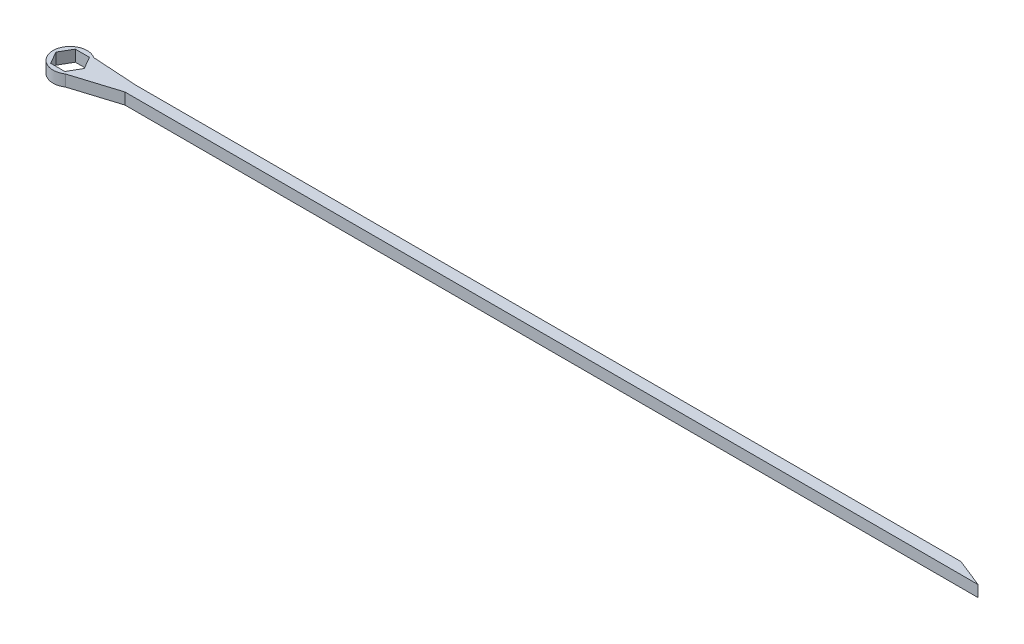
SolidWorks part; units mm, degrees
ref_plane "Front Plane" through (0, 0, 0) normal (0, 0, 1) x (1, 0, 0)
ref_plane "Top Plane" through (0, 0, 0) normal (0, 1, 0) x (1, 0, 0)
ref_plane "Right Plane" through (0, 0, 0) normal (1, 0, 0) x (0, 0, -1)
sketch "Sketch1" plane through (0, 0, 0) normal (0, 1, 0) x (1, 0, 0)
  line L0 (4.8292, 0) -> (80, 0)
  line L2 (1.25, 0) -> (0.625, 1.0825)
  line L3 (0.625, 1.0825) -> (-0.625, 1.0825)
  line L4 (-0.625, 1.0825) -> (-1.25, 0)
  line L5 (-1.25, 0) -> (-0.625, -1.0825)
  line L6 (-0.625, -1.0825) -> (0.625, -1.0825)
  line L7 (0.625, -1.0825) -> (1.25, 0)
  line L10 (80, 0) -> (77.5, 1)
  line L11 (77.5, 1) -> (4.8292, 1)
  line L12 (4.8292, 1) -> (0.8292, 1.25)
  line L13 (4.8292, 0) -> (0.8292, -1.25)
  arc A0 (0.8292, 1.25) -> (0.8292, -1.25) centre (0, 0) ccw
  circle A1 centre (0, 0) radius 1.25 construction
  dimension "D1" = 3
  dimension "D2" = 2.5
  dimension "D3" = 1
  dimension "D4" = 2.5
  dimension "D5" = 1.25
  dimension "D6" = 4
  dimension "D8" = 1.25
extrude "Boss-Extrude1" add sketch "Sketch1" along normal blind 1
sketch "Sketch2" plane through (0, 1, 0) normal (0, 1, 0) x (1, 0, 0)
  line L0 (0, 0) -> (16, 0)
  line L1 (4.8292, 0) -> (80, 0) construction
  line L2 (16, 0) -> (23.6429, 0)
  line L3 (23.6429, 0) -> (31.2857, 0)
  line L4 (31.2857, 0) -> (38.9286, 0)
  line L5 (38.9286, 0) -> (46.5714, 0)
  line L6 (46.5714, 0) -> (54.2143, 0)
  line L7 (54.2143, 0) -> (61.8571, 0)
  line L8 (61.8571, 0) -> (69.5, 0)
  line L10 (69.5, 0) -> (77.5, 0)
  dimension "D1" = 16
  dimension "D2" = 8
